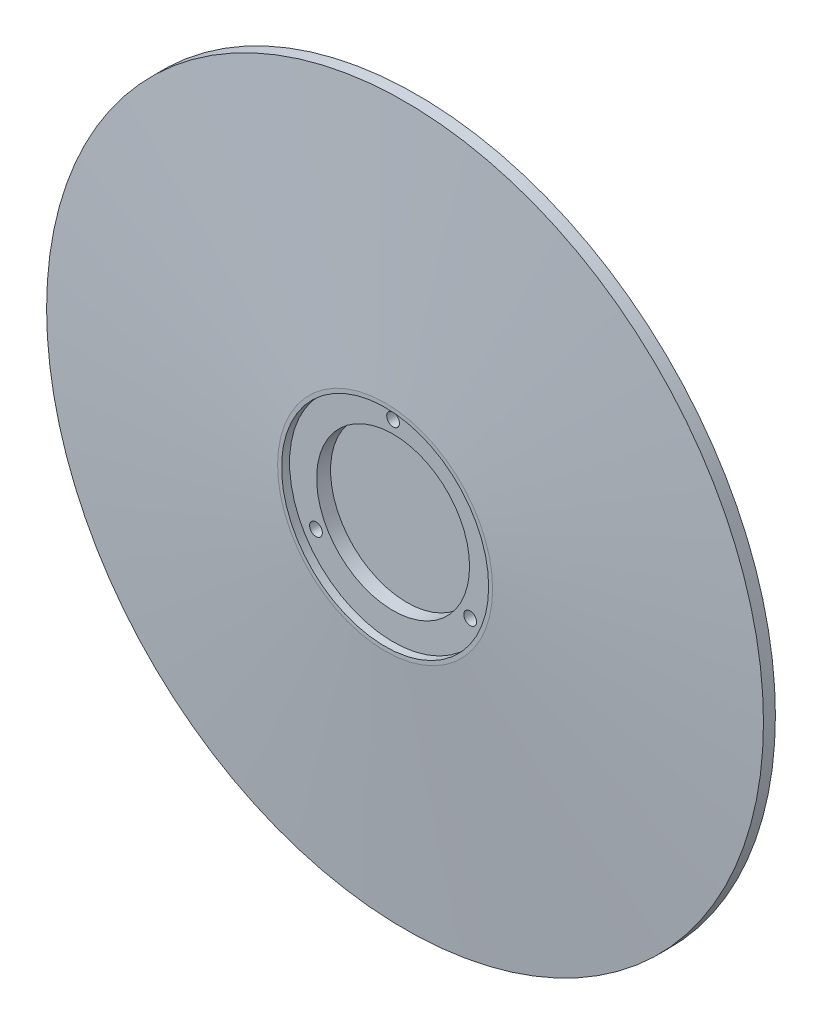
SolidWorks part; units mm, degrees
ref_plane "Спереди" through (0, 0, 0) normal (0, 0, 1) x (1, 0, 0)
ref_plane "Сверху" through (0, 0, 0) normal (0, 1, 0) x (1, 0, 0)
ref_plane "Справа" through (0, 0, 0) normal (1, 0, 0) x (0, 0, -1)
sketch "Эскиз1" plane through (0, 0, 0) normal (1, 0, 0) x (0, 0, -1)
  line L0 (0, 0) -> (0, 90)
  line L1 (0, 90) -> (-3, 90)
  line L2 (-3, 90) -> (-8, 27)
  line L3 (-8, 27) -> (-8, 0)
  line L4 (-8, 0) -> (0, 0)
  line L5 (33.3509, 0) -> (-42.5756, 0) construction
  dimension "D1" = 180
  dimension "D2" = 8
  dimension "D3" = 3
  dimension "D4" = 54
revolve "Повернуть1" add sketch "Эскиз1" angle 360 about L5
sketch "Эскиз2" plane through (0, 0, 8) normal (0, 0, 1) x (1, 0, 0)
  circle A0 centre (0, 0) radius 26
  dimension "D1" = 52
extrude "Вырез-Вытянуть1" cut sketch "Эскиз2" against normal blind 2
sketch "Эскиз3" plane through (0, 0, 6) normal (0, 0, 1) x (1, 0, 0)
  circle A0 centre (0, 0) radius 19.2
  dimension "D1" = 38.4
extrude "Вырез-Вытянуть2" cut sketch "Эскиз3" against normal blind 3.5
sketch "Эскиз4" plane through (0, 0, 6) normal (0, 0, 1) x (1, 0, 0)
  line L0 (0, 0) -> (0, 26) construction
  line L1 (0, 0) -> (19.3557, -11.175) construction
  circle A0 centre (0, 0) radius 26 construction
  circle A1 centre (0, 0) radius 22.35 construction
  circle A2 centre (0, 0) radius 19.2 construction
  circle A3 centre (0, 22.35) radius 1.6
  circle A4 centre (19.3557, -11.175) radius 1.6
  circle A5 centre (-19.3557, -11.175) radius 1.6
  point P17 (0, 0)
  dimension "D1" = 3.15
  dimension "D2" = 3.2
  dimension "D4" = 120
  dimension "D3" = 3
extrude "Вырез-Вытянуть3" cut sketch "Эскиз4" against normal blind 4
